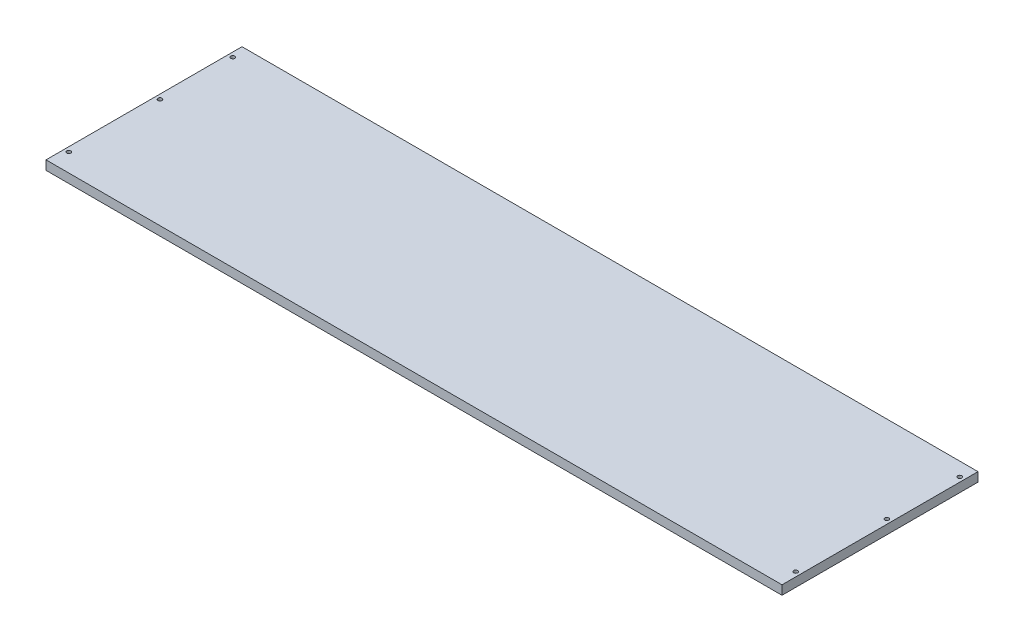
SolidWorks part; units mm, degrees
ref_plane "Front" through (0, 0, 0) normal (0, 0, 1) x (1, 0, 0)
ref_plane "Top" through (0, 0, 0) normal (0, 1, 0) x (1, 0, 0)
ref_plane "Right" through (0, 0, 0) normal (1, 0, 0) x (0, 0, -1)
sketch "Sketch1" plane through (0, 0, 0) normal (0, 1, 0) x (1, 0, 0)
  line L1 (0, 0) -> (1025.398, 0)
  line L2 (0, 0) -> (0, 304.8)
  line L3 (0, 304.8) -> (1025.398, 304.8)
  line L4 (1025.398, 0) -> (1025.398, 304.8)
  dimension "D1" = 1025.398
  dimension "D2" = 304.8
extrude "Extrude1" add sketch "Sketch1" along normal blind 12.7
sketch "Sketch2" plane through (0, 12.7, 0) normal (0, 1, 0) x (1, 0, 0)
  line L0 (0, 152.4) -> (1025.398, 152.4) construction
  line L1 (0, 304.8) -> (0, 0) construction
  line L2 (1025.398, 0) -> (1025.398, 304.8) construction
  line L3 (512.699, 304.8) -> (512.699, 0) construction
  line L4 (1025.398, 304.8) -> (0, 304.8) construction
  line L5 (0, 0) -> (1025.398, 0) construction
  line L6 (1019.048, 319.4563) -> (1019.048, -17.9001) construction
  line L7 (6.35, 310.3736) -> (6.35, -17.9001) construction
  line L8 (1025.398, 304.8) -> (0, 304.8) construction
  circle A0 centre (1019.048, 254) radius 2.8067
  circle A1 centre (1019.048, 152.4) radius 2.8067
  circle A4 centre (6.35, 152.4) radius 2.8067
  circle A5 centre (6.35, 254) radius 2.8067
  circle A6 centre (1019.048, 25.4) radius 2.8067
  circle A7 centre (6.35, 25.4) radius 2.8067
  dimension "D3" = 5.6134
  dimension "D4" = 50.8
  dimension "D1" = 6.35
  dimension "D2" = 6.35
extrude "Extrude2" cut sketch "Sketch2" against normal through all
sketch "Sketch3" plane through (0, 12.7, 0) normal (0, 1, 0) x (1, 0, 0)
  line L0 (1025.398, 304.8) -> (0, 304.8) construction
  line L1 (-28.3688, 335.9799) -> (1051.8205, 335.9799)
  line L2 (-28.3688, 335.9799) -> (-28.3688, 273.05)
  line L3 (-28.3688, 273.05) -> (1051.8205, 273.05)
  line L4 (1051.8205, 335.9799) -> (1051.8205, 273.05)
  dimension "D1" = 31.75
extrude "Extrude3" cut sketch "Sketch3" against normal through all
